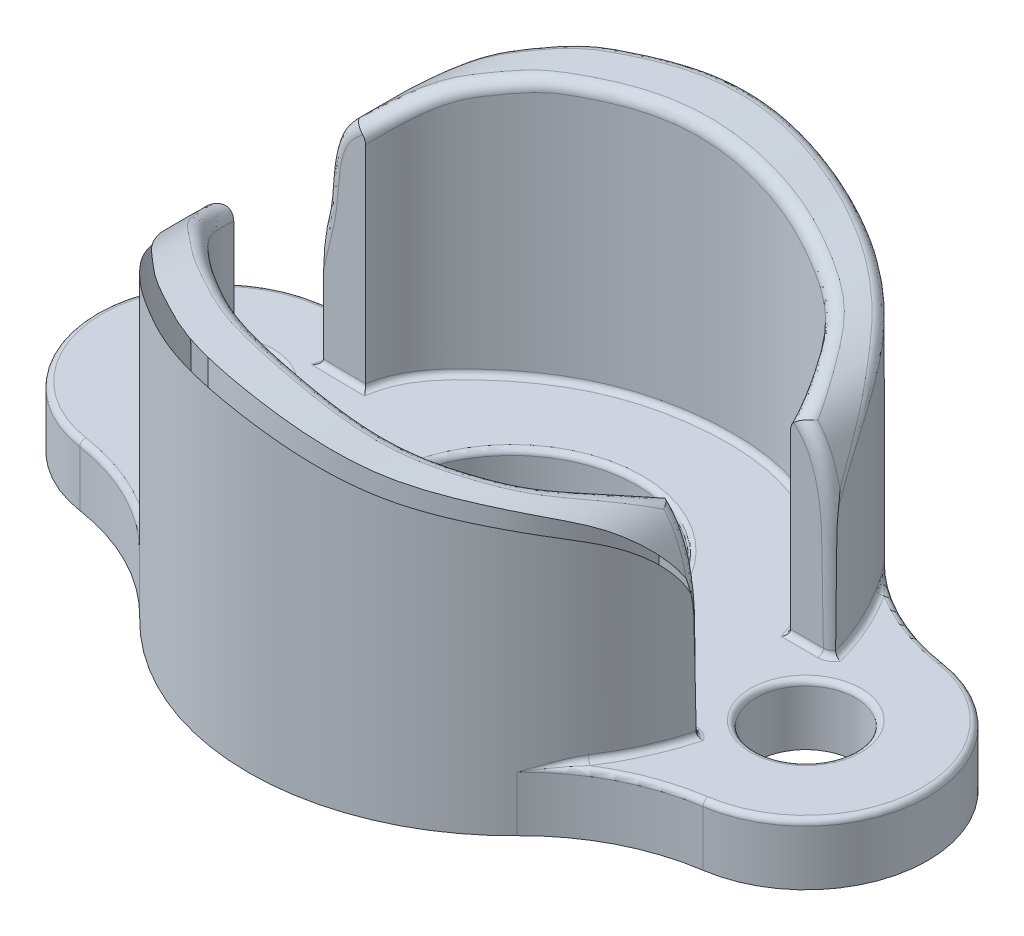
SolidWorks part; units mm, degrees
ref_plane "Alzado" through (0, 0, 0) normal (0, 0, 1) x (1, 0, 0)
ref_plane "Planta" through (0, 0, 0) normal (0, 1, 0) x (1, 0, 0)
ref_plane "Vista lateral" through (0, 0, 0) normal (1, 0, 0) x (0, 0, -1)
sketch "Croquis2" plane through (0, 0, 0) normal (0, 1, 0) x (1, 0, 0)
  line L0 (-1003.8261, 0) -> (2.856, 0) construction
  line L1 (0, 0) -> (0, -4.4018) construction
  line L2 (122.8178, -241.9208) -> (207.3526, -169.9417) construction
  line L3 (96.7604, 8.4494) -> (363.5721, 8.4494) construction
  circle A0 centre (6.731, 0) radius 1.143
  arc A1 (-4.3256, -4.206) -> (4.3256, -4.206) centre (0, 0) ccw
  circle A2 centre (-6.731, 0) radius 1.143
  circle A3 centre (0, 0) radius 2.856
  arc A4 (4.3256, 4.206) -> (-4.3256, 4.206) centre (0, 0) ccw
  arc A5 (7.1412, -2.7637) -> (7.1412, 2.7637) centre (6.731, 0) ccw
  arc A6 (-7.1412, 2.7637) -> (-7.1412, -2.7637) centre (-6.731, 0) ccw
  arc A7 (-4.3256, -4.206) -> (-7.1412, -2.7637) centre (-7.8663, -7.6488) ccw
  arc A8 (-4.3256, 4.206) -> (-7.1412, 2.7637) centre (-7.8663, 7.6488) cw
  arc A9 (4.3256, -4.206) -> (7.1412, -2.7637) centre (7.8663, -7.6488) cw
  arc A10 (4.3256, 4.206) -> (7.1412, 2.7637) centre (7.8663, 7.6488) ccw
  dimension "D1" = 6.731
  dimension "D3" = 2.286
extrude "Saliente-Extruir1" add sketch "Croquis2" along normal mid plane 1.3891
sketch "Croquis4" plane through (0, 0.6945, 0) normal (0, 1, 0) x (1, 0, 0)
  line L0 (4.8755, -1.5096) -> (5.8414, -1.5096)
  line L1 (-1.2808, 0) -> (4.2402, 0) construction
  line L2 (-201003.8261, 0) -> (2.856, 0) construction
  line L3 (4.8755, 1.5096) -> (5.8414, 1.5096)
  arc A0 (-5.8381, -1.5225) -> (5.8414, -1.5096) centre (0, 0) ccw
  arc A1 (4.3256, 4.206) -> (-4.3256, 4.206) centre (0, 0) ccw construction
  arc A2 (5.8414, 1.5096) -> (-5.8381, 1.5225) centre (0, 0) ccw
  spline S0 degree 1 poles (-5.8381, -1.5225) (-4.8664, -1.5096) knots 0 0 1 1
  spline S1 degree 3 poles (-4.8664, -1.5096) (-4.758, -2.1731) (-4.092, -2.9453) (-3.0225, -3.8071) (-1.8909, -4.4115) (-0.5441, -4.7332) (0.7171, -4.763) (1.8596, -4.566) (2.8067, -4.1436) (3.7101, -3.5592) (4.3656, -2.6521) (4.7331, -1.9697) (4.8755, -1.5096) knots 0 0 0 0 0.152073 0.239449 0.329349 0.457552 0.567878 0.630128 0.734272 0.815003 0.88463 1 1 1 1
  spline S2 degree 3 poles (-4.8664, 1.5096) (-4.758, 2.1731) (-4.092, 2.9453) (-3.0225, 3.8071) (-1.8909, 4.4115) (-0.5441, 4.7332) (0.7171, 4.763) (1.8596, 4.566) (2.8067, 4.1436) (3.7101, 3.5592) (4.3656, 2.6521) (4.7331, 1.9697) (4.8755, 1.5096) knots 0 0 0 0 0.152073 0.239449 0.329349 0.457552 0.567878 0.630128 0.734272 0.815003 0.88463 1 1 1 1
  spline S3 degree 1 poles (-5.8381, 1.5225) (-4.8664, 1.5096) knots 0 0 1 1
extrude "Saliente-Extruir2" add sketch "Croquis4" along normal blind 8.7709
sketch "Croquis5" plane through (0, 0, 0) normal (0, 0, 1) x (1, 0, 0)
  line L0 (52.7532, 97.2883) -> (68.7252, 97.2883) construction
  line L1 (9.525, -0.6448) -> (9.525, 11.5897) construction
  line L2 (9.525, -0.6945) -> (9.525, 0.6945) construction
sketch "Croquis6" plane through (0, 0, 0) normal (0, 0, 1) x (1, 0, 0)
  line L0 (-5.8381, 9.4655) -> (-5.8381, 0.6945) construction
  line L1 (5.8414, 9.4655) -> (5.8414, 0.6945) construction
  line L2 (-5.8381, 3.6871) -> (-5.8381, 11.0733)
  line L3 (-5.8381, 11.0733) -> (5.8414, 11.0733)
  line L4 (5.8414, 3.0148) -> (5.8414, 11.0733)
  spline S0 degree 3 poles (-5.8381, 3.6871) (-5.7066, 4.2407) (-5.8319, 5.2959) (-4.9669, 6.0462) (-4.4304, 6.3927) (-3.7463, 6.5473) (-3.1929, 6.6704) (-2.3002, 6.6562) (-1.3071, 6.6989) (0.4577, 6.547) (2.3411, 5.9525) (4.1227, 5.6871) (5.2577, 5.1295) (5.7531, 4.2458) (5.8346, 3.4127) (5.8414, 3.0148) knots 0 0 0 0 0.122095 0.165936 0.214256 0.244241 0.300555 0.323179 0.41635 0.492677 0.663979 0.795608 0.840379 0.90126 0.9845 0.9845 0.9845 0.9845
extrude "Cortar-Extruir1" cut sketch "Croquis6" against normal mid plane 18.796
fillet "Redondeo1" radius 0.254 8 edges at (-0.1897, 6.5849, -4.718) (-5.6106, 5.218, -1.5194) (-0.7282, 6.6425, -5.9892) (-0.6449, 6.6357, 5.9988) (-5.5727, 5.3205, 1.5189) (-0.4152, 6.6129, 4.6959)
fillet "Redondeo6" radius 0.127 21 edges at (5.6148, 0.6945, -3.2533) (9.525, 0.6945, 0) (5.6148, 0.6945, 3.2533) (5.2371, 0.6945, 2.9956) (5.7113, 0.6945, 1.5239) (5.2513, 0.6945, 1.5096) (-5.256, 0.6945, 2.9624) (-5.6148, 0.6945, 3.2533) (-9.525, 0.6945, 0) (-5.6148, 0.6945, -3.2533) (-5.256, 0.6945, -2.9624) (5.2513, 0.6945, -1.5096) (5.7522, 0.6945, -1.5424) (5.2371, 0.6945, -2.9956) (6.731, 0.6945, 1.143) (-6.731, 0.6945, -1.143) (0, 0.6945, 2.856)
